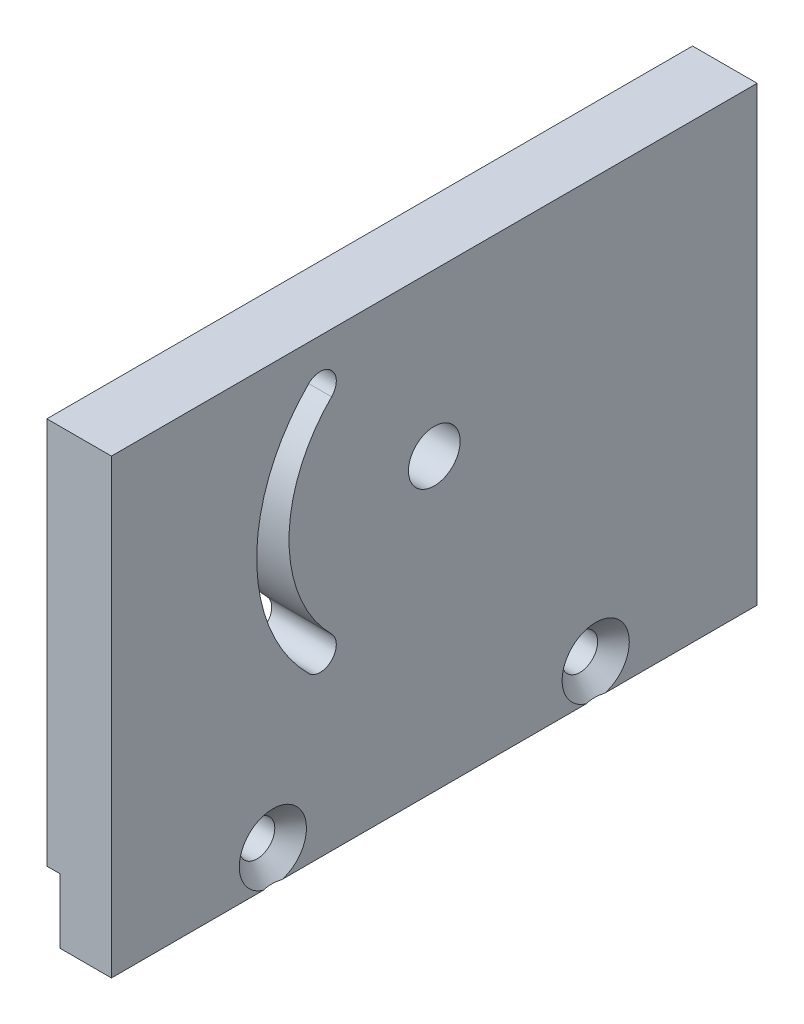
SolidWorks part; units mm, degrees
ref_plane "Plan de face" through (0, 0, 0) normal (0, 0, 1) x (1, 0, 0)
ref_plane "Plan de dessus" through (0, 0, 0) normal (0, 1, 0) x (1, 0, 0)
ref_plane "Plan de droite" through (0, 0, 0) normal (1, 0, 0) x (0, 0, -1)
sketch "Esquisse1" plane through (0, 0, 0) normal (0, 0, 1) x (1, 0, 0)
  line L0 (68, 10) -> (68, 70)
  line L1 (70, 10) -> (0, 10) construction
  line L2 (68, 70) -> (78, 70)
  line L3 (78, 70) -> (78, 0)
  line L4 (78, 0) -> (70, 0)
  line L5 (70, 0) -> (70, 10) construction
  line L6 (70, 0) -> (70, 10)
  line L7 (70, 10) -> (68, 10)
  dimension "D1" = 2
  dimension "D2" = 70
  dimension "D3" = 10
extrude "Boss.-Extru.1" add sketch "Esquisse1" against normal up to vertex (100 mm away)
hole_wizard "Fraisage pour vis à tête fraisée M51" positions "Esquisse3" profile "Esquisse2" countersink size "M5" standard "Ansi Metric"
sketch "Esquisse3" plane through (78, 0, 0) normal (1, 0, 0) x (0, 0, -1)
  point P0 (25, 5)
  point P3 (75, 5)
sketch "Esquisse2" plane through (78, 5, -25) normal (0, 1, 0) x (0, 0, -1)
  line L0 (0, 0) -> (0, 10)
  line L1 (0, 10) -> (2.75, 10)
  line L2 (2.75, 10) -> (2.75, 2.45)
  line L3 (2.75, 2.45) -> (5.2, 0)
  line L5 (5.2, 0) -> (0, 0)
  line L6 (-2.75, 2.45) -> (-5.2, 0) construction
  line L11 (0, -6.35) -> (0, 107.95) construction
  dimension "Diamètre du perçage jusqu'au prochain" = 5.5
  dimension "Profondeur du perçage jusqu'au prochain" = 10
  dimension "Diamètre du fraisage entrant" = 10.4
  dimension "Angle du fraisage entrant" = 90
sketch "Esquisse4" plane through (78, 0, 0) normal (1, 0, 0) x (0, 0, -1)
  line L0 (73.5717, 0) -> (26.4283, 0) construction
  line L2 (0, 0) -> (0, 70) construction
  circle A0 centre (50, 45) radius 4
  dimension "D1" = 8
  dimension "D2" = 45
  dimension "D3" = 50
extrude "Enlèv. mat.-Extru.1" cut sketch "Esquisse4" against normal blind 10
sketch "Esquisse5" plane through (78, 0, 0) normal (1, 0, 0) x (0, 0, -1)
  line L0 (50, 45) -> (32.3223, 62.6777) construction
  line L1 (50, 45) -> (32.3223, 27.3223) construction
  line L2 (50, 45) -> (14.6872, 45) construction
  arc A0 (34.0901, 60.9099) -> (34.0901, 29.0901) centre (50, 45) ccw
  arc A1 (30.5546, 64.4454) -> (30.5546, 25.5546) centre (50, 45) ccw
  arc A2 (34.0901, 60.9099) -> (30.5546, 64.4454) centre (32.3223, 62.6777) ccw
  arc A3 (30.5546, 25.5546) -> (34.0901, 29.0901) centre (32.3223, 27.3223) ccw
  dimension "D1" = 45
  dimension "D2" = 55
  dimension "D5" = 2.5
  dimension "D3" = 45
  dimension "D4" = 45
extrude "Enlèv. mat.-Extru.2" cut sketch "Esquisse5" against normal through all
